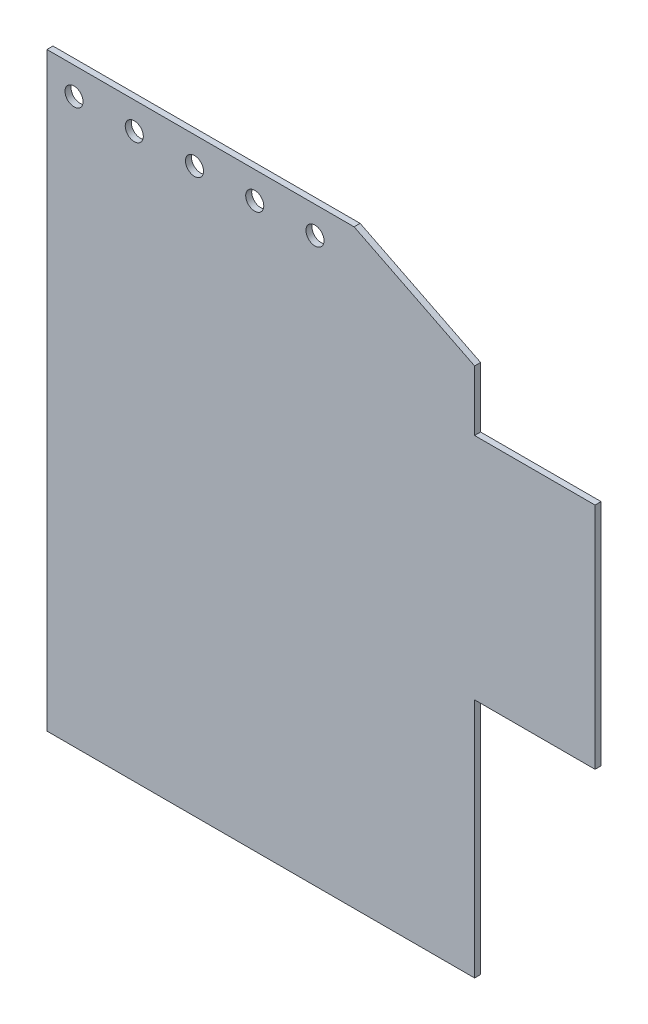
SolidWorks part; units mm, degrees
ref_plane "Front" through (0, 0, 0) normal (0, 0, 1) x (1, 0, 0)
ref_plane "Top" through (0, 0, 0) normal (0, 1, 0) x (1, 0, 0)
ref_plane "Right" through (0, 0, 0) normal (1, 0, 0) x (0, 0, -1)
sketch "草图3" plane through (0, 0, 0) normal (0, 0, 1) x (1, 0, 0)
  line L2 (-14.9357, 46.1782) -> (-14.9357, -51.8218)
  line L3 (-14.9357, -51.8218) -> (56.0643, -51.8218)
  line L6 (36.0643, 46.1782) -> (56.0643, 36.1782)
  line L7 (-14.9357, 46.1782) -> (36.0643, 46.1782)
  line L9 (56.0643, 36.1782) -> (56.0643, 26.1782)
  line L10 (76.0643, 26.1782) -> (56.0643, 26.1782)
  line L11 (76.0643, 26.1782) -> (76.0643, -11.8218)
  line L12 (76.0643, -11.8218) -> (56.0643, -11.8218)
  line L13 (56.0643, -11.8218) -> (56.0643, -51.8218)
  circle A0 centre (-10.4357, 41.6782) radius 1.5
  circle A1 centre (-0.4357, 41.6782) radius 1.5
  circle A2 centre (9.5643, 41.6782) radius 1.5
  circle A3 centre (19.5643, 41.6782) radius 1.5
  circle A4 centre (29.5643, 41.6782) radius 1.5
  dimension "D2" = 20
  dimension "D5" = 4.5
  dimension "D7" = 10
  dimension "D1" = 98
  dimension "D3" = 10
  dimension "D4" = 38
  dimension "D6" = 4.5
  dimension "D8" = 4
extrude "凸台-拉伸1" add sketch "草图3" along normal blind 1
